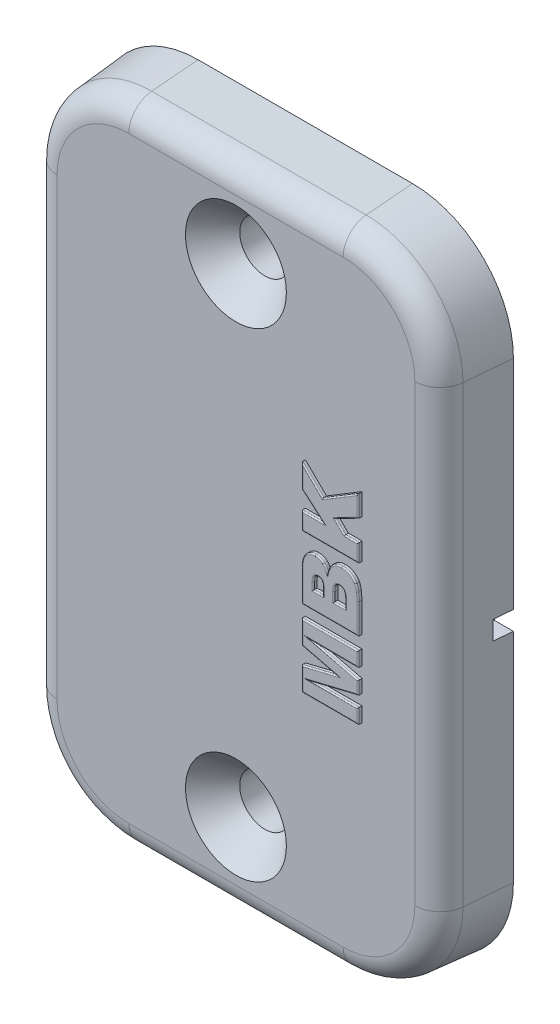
SolidWorks part; units mm, degrees
ref_plane "Plan1" through (0, 0, 0) normal (0, 0, 1) x (1, 0, 0)
ref_plane "Plan2" through (0, 0, 0) normal (0, 1, 0) x (1, 0, 0)
ref_plane "Plan3" through (0, 0, 0) normal (1, 0, 0) x (0, 0, -1)
sketch "Esquisse1" plane through (0, 0, 0) normal (0, 0, 1) x (1, 0, 0)
  line L4 (-33, 18) -> (-33, -18)
  line L5 (-25, -26) -> (-8, -26)
  line L6 (0, -18) -> (0, 18)
  line L7 (-8, 26) -> (-25, 26)
  line L8 (-33, 18) -> (-33, -18)
  line L9 (-25, -26) -> (-8, -26)
  line L10 (0, -18) -> (0, 18)
  line L11 (-8, 26) -> (-25, 26)
  arc A4 (-33, -18) -> (-25, -26) centre (-25, -18) ccw
  arc A5 (-8, -26) -> (0, -18) centre (-8, -18) ccw
  arc A6 (0, 18) -> (-8, 26) centre (-8, 18) ccw
  arc A7 (-25, 26) -> (-33, 18) centre (-25, 18) ccw
  arc A8 (-33, -18) -> (-25, -26) centre (-25, -18) ccw
  arc A9 (-8, -26) -> (0, -18) centre (-8, -18) ccw
  arc A10 (0, 18) -> (-8, 26) centre (-8, 18) ccw
  arc A11 (-25, 26) -> (-33, 18) centre (-25, 18) ccw
  dimension "D1" = 0
extrude "Base-Extrusion" add sketch "Esquisse1" along normal blind 5.5
sketch "Esquisse2" plane through (0, 0, 0) normal (0, 0, -1) x (-1, 0, 0)
  line L0 (25, 24) -> (8, 24)
  line L1 (31, -18) -> (31, 18)
  line L2 (8, -24) -> (25, -24)
  line L3 (2, 18) -> (2, -18)
  line L4 (25, 26) -> (8, 26)
  line L5 (0, 18) -> (0, -18)
  line L6 (8, -26) -> (25, -26)
  line L7 (33, -18) -> (33, 18)
  line L8 (25, 26) -> (8, 26) construction
  line L9 (0, 18) -> (0, -18) construction
  line L10 (8, -26) -> (25, -26) construction
  line L11 (33, -18) -> (33, 18) construction
  arc A0 (31, 18) -> (25, 24) centre (25, 18) ccw
  arc A1 (25, -24) -> (31, -18) centre (25, -18) ccw
  arc A2 (2, -18) -> (8, -24) centre (8, -18) ccw
  arc A3 (8, 24) -> (2, 18) centre (8, 18) ccw
  arc A4 (33, 18) -> (25, 26) centre (25, 18) ccw
  arc A5 (8, 26) -> (0, 18) centre (8, 18) ccw
  arc A6 (0, -18) -> (8, -26) centre (8, -18) ccw
  arc A7 (25, -26) -> (33, -18) centre (25, -18) ccw
  arc A8 (33, 18) -> (25, 26) centre (25, 18) ccw construction
  arc A9 (8, 26) -> (0, 18) centre (8, 18) ccw construction
  arc A10 (0, -18) -> (8, -26) centre (8, -18) ccw construction
  arc A11 (25, -26) -> (33, -18) centre (25, -18) ccw construction
  dimension "D1" = 0
  dimension "D2" = 2
extrude "Enlèv. mat.-Extru.1" cut sketch "Esquisse2" against normal blind 1
sketch "Esquisse3" plane through (0, 0, 5.5) normal (0, 0, 1) x (1, 0, 0)
  line L0 (-27, 16) -> (-27, -16)
  line L1 (-33, 18) -> (-33, -18) construction
  line L2 (-6, 16) -> (-6, -16)
  line L4 (0, -18) -> (0, 18) construction
  arc A0 (-20.5, 19) -> (-12.5, 19) centre (-16.5, 19) ccw construction
  arc A1 (-20.5, 19) -> (-12.5, 19) centre (-16.5, 19) ccw construction
  arc A2 (-21.1389, 17.1344) -> (-11.8611, 17.1344) centre (-16.5, 19) ccw
  arc A3 (-27, 16) -> (-21.1389, 17.1344) centre (-23.9597, 16) cw
  arc A4 (-6, 16) -> (-11.8611, 17.1344) centre (-9.0403, 16) ccw
  arc A5 (-12.5, -19) -> (-20.5, -19) centre (-16.5, -19) ccw construction
  arc A6 (-12.5, -19) -> (-20.5, -19) centre (-16.5, -19) ccw construction
  arc A7 (-11.8611, -17.1344) -> (-21.1389, -17.1344) centre (-16.5, -19) ccw
  arc A8 (-27, -16) -> (-21.1389, -17.1344) centre (-23.9597, -16) ccw
  arc A9 (-6, -16) -> (-11.8611, -17.1344) centre (-9.0403, -16) cw
  point P26 (-27, 0)
  point P27 (-6, 0)
  dimension "D1" = 10
  dimension "D3" = 6
  dimension "D2" = 10
  dimension "D6" = 32
  dimension "D4" = 6
  dimension "D7" = 32
extrude "Boss.-Extru.1" add sketch "Esquisse3" against normal blind 10
sketch "Esquisse4" plane through (0, 0, -4.5) normal (0, 0, -1) x (-1, 0, 0)
  line L0 (25.5, -16) -> (25.5, 16)
  line L1 (7.5, 16) -> (7.5, -16)
  line L2 (6, 16) -> (6, -16)
  line L3 (27, -16) -> (27, 16)
  line L4 (6, 16) -> (6, -16) construction
  line L5 (27, -16) -> (27, 16) construction
  arc A0 (10.4694, 16.5747) -> (22.5306, 16.5747) centre (16.5, 19) ccw
  arc A1 (25.5, 16) -> (22.5306, 16.5747) centre (23.9597, 16) ccw
  arc A2 (22.5306, -16.5747) -> (25.5, -16) centre (23.9597, -16) ccw
  arc A3 (22.5306, -16.5747) -> (10.4694, -16.5747) centre (16.5, -19) ccw
  arc A4 (7.5, -16) -> (10.4694, -16.5747) centre (9.0403, -16) ccw
  arc A5 (10.4694, 16.5747) -> (7.5, 16) centre (9.0403, 16) ccw
  arc A6 (27, 16) -> (21.1389, 17.1344) centre (23.9597, 16) ccw
  arc A7 (11.8611, 17.1344) -> (21.1389, 17.1344) centre (16.5, 19) ccw
  arc A8 (11.8611, 17.1344) -> (6, 16) centre (9.0403, 16) ccw
  arc A9 (6, -16) -> (11.8611, -17.1344) centre (9.0403, -16) ccw
  arc A10 (21.1389, -17.1344) -> (11.8611, -17.1344) centre (16.5, -19) ccw
  arc A11 (21.1389, -17.1344) -> (27, -16) centre (23.9597, -16) ccw
  arc A12 (27, 16) -> (21.1389, 17.1344) centre (23.9597, 16) ccw construction
  arc A13 (11.8611, 17.1344) -> (21.1389, 17.1344) centre (16.5, 19) ccw construction
  arc A14 (11.8611, 17.1344) -> (6, 16) centre (9.0403, 16) ccw construction
  arc A15 (6, -16) -> (11.8611, -17.1344) centre (9.0403, -16) ccw construction
  arc A16 (21.1389, -17.1344) -> (11.8611, -17.1344) centre (16.5, -19) ccw construction
  arc A17 (21.1389, -17.1344) -> (27, -16) centre (23.9597, -16) ccw construction
  dimension "D2" = 1.5
  dimension "D1" = 0
extrude "Enlèv. mat.-Extru.2" cut sketch "Esquisse4" against normal blind 6.5
sketch "Esquisse5" plane through (0, 0, -4.5) normal (0, 0, -1) x (-1, 0, 0)
  line L0 (0, -18) -> (0, 18) construction
  line L1 (0, 0.75) -> (7.5, 0.75)
  line L2 (0, 0.75) -> (0, -0.75)
  line L3 (0, -0.75) -> (7.5, -0.75)
  line L4 (7.5, 0.75) -> (7.5, -0.75)
  line L5 (7.5, 16) -> (7.5, -16) construction
  point P8 (7.5, 0)
  dimension "D1" = 1.5
extrude "Enlèv. mat.-Extru.3" cut sketch "Esquisse5" against normal blind 6
draft "Dépouille1" type of draft neutral plane draft angle 5 faces to draft 1 parameters "D1"=5
fillet "Congé1" radius 2
hole_wizard "Perçage1" positions "Esquisse7" profile "Esquisse6" legacy
sketch "Esquisse7" plane through (0, 0, 5.5) normal (0, 0, 1) x (1, 0, 0)
  arc A0 (-21.1389, 17.1344) -> (-11.8611, 17.1344) centre (-16.5, 19) ccw construction
  point P0 (-16.5, 19)
sketch "Esquisse6" plane through (-16.5, 19, 5.5) normal (1, 0, 0) x (0, -1, 0)
  line L0 (0, 0) -> (0, 10)
  line L1 (0, 10) -> (2, 10)
  line L2 (2, 10) -> (2, 2.3007)
  line L3 (2, 2.3007) -> (4, 0)
  line L4 (4, 0) -> (0, 0)
  line L5 (0, -6.4453) -> (0, 115.525) construction
  line L6 (-2, 2.3007) -> (-4, 0) construction
  dimension "Diamètre" = 4
  dimension "Profondeur" = 10
  dimension "Angle fraisé" = 82
  dimension "Diamètre fraisé" = 8
mirror "Symétrie1" about plane through (0, 0, 0) normal (0, 1, 0)
sketch "Esquisse8" plane through (-18.5645, 14.717, 5.5) normal (0, 0, 1) x (0, 1, 0)
  arc A0 (2.4174, 2.5744) -> (2.4174, -6.7034) centre (4.283, -2.0645) ccw construction
  circle A2 centre (4.283, -2.0645) radius 2 construction
  text T0 "MBK" font "Arial Black" height 4.5
  dimension "D2" = 10
  dimension "D1" = 27
extrude "Boss.-Extru.2" add sketch "Esquisse8" along normal blind 0.3
fillet "Congé2" radius 0.1
